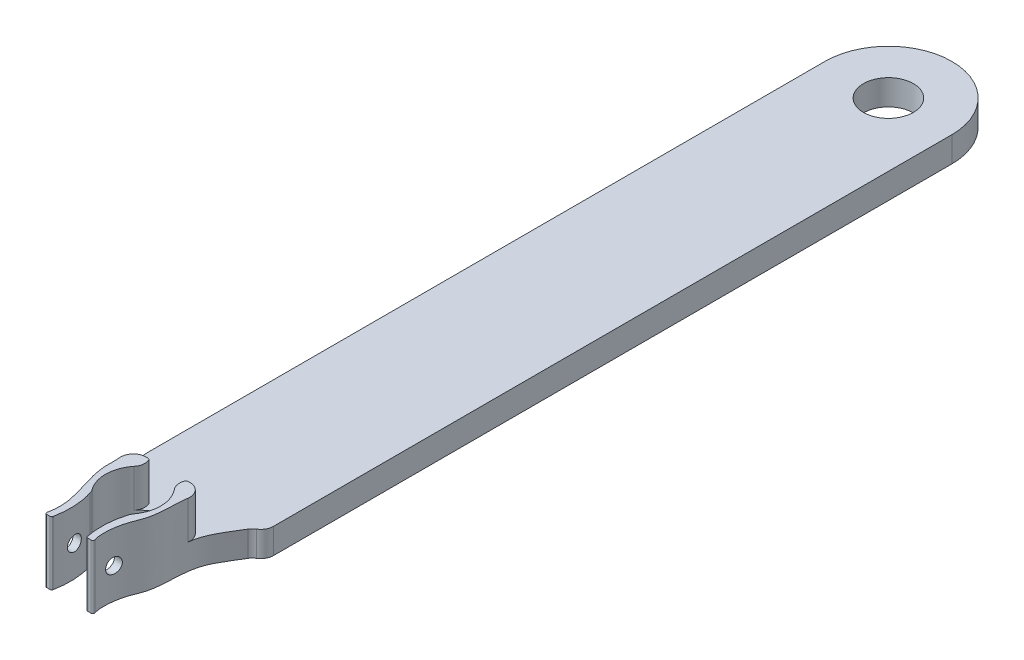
SolidWorks part; units mm, degrees
ref_plane "Front Plane" through (0, 0, 0) normal (0, 0, 1) x (1, 0, 0)
ref_plane "Top Plane" through (0, 0, 0) normal (0, 1, 0) x (1, 0, 0)
ref_plane "Right Plane" through (0, 0, 0) normal (1, 0, 0) x (0, 0, -1)
sketch "Sketch1" plane through (0, 0, 0) normal (0, 1, 0) x (1, 0, 0)
  line L0 (0, 12.7) -> (0, -18.5764) construction
  line L1 (-4.4511, -32.1986) -> (-3.776, -32.1986)
  line L2 (4.4511, -32.1986) -> (3.776, -32.1986)
  arc A0 (-12.6901, -0.502) -> (12.6901, -0.502) centre (0, 0) cw
  circle A1 centre (0, 0) radius 2.54
  arc A2 (-12.6901, -0.502) -> (12.6901, -0.502) centre (0, 0) ccw construction
  arc A3 (0, -12.7) -> (-4.2124, -23.3606) centre (1.256, -19.3588) ccw
  arc A4 (-4.2124, -23.3606) -> (-3.8349, -24.1124) centre (-6.2622, -24.8607) cw
  arc A5 (-3.4519, -31.9324) -> (-3.776, -32.1986) centre (-3.776, -31.8683) cw
  arc A6 (-4.7735, -31.7962) -> (-4.4511, -32.1986) centre (-4.4511, -31.8683) ccw
  arc A7 (4.7735, -31.7962) -> (4.4511, -32.1986) centre (4.4511, -31.8683) cw
  arc A8 (3.4519, -31.9324) -> (3.776, -32.1986) centre (3.776, -31.8683) ccw
  arc A9 (4.2124, -23.3606) -> (3.8349, -24.1124) centre (6.2622, -24.8607) ccw
  arc A10 (0, -12.7) -> (4.2124, -23.3606) centre (-1.256, -19.3588) cw
  spline S0 degree 3 poles (-12.6901, -0.502) (-12.7086, -0.5346) (-12.9445, -3.8187) (-6.4425, -13.8865) (-7.3603, -18.4592) (-5.2739, -24.7591) (-4.156, -29.0329) (-4.7735, -31.7962) knots 0 0 0 0 0.279659 0.433864 0.566787 0.759909 0.988954 0.988954 0.988954 0.988954
  spline S1 degree 3 poles (-3.8349, -24.1124) (-3.6668, -24.6575) (-3.0286, -27.202) (-3.0384, -29.8419) (-3.4519, -31.9324) knots 0.055076 0.055076 0.055076 0.055076 0.252507 0.96957 0.96957 0.96957 0.96957
  spline S2 degree 3 poles (3.8349, -24.1124) (3.6668, -24.6575) (3.0286, -27.202) (3.0384, -29.8419) (3.4519, -31.9324) knots 0.055076 0.055076 0.055076 0.055076 0.252507 0.96957 0.96957 0.96957 0.96957
  spline S3 degree 3 poles (12.6901, -0.502) (12.8342, -5.638) (5.4885, -11.2875) (7.0856, -20.9954) (4.5252, -26.6602) (4.2626, -30.148) (4.7735, -31.7962) knots 0 0 0 0 0.420411 0.703009 0.760968 1 1 1 1
  dimension "D1" = 12.7
  dimension "D2" = 5.08
  dimension "D3" = 2.54
  dimension "D4" = 0.3304
extrude "Boss-Extrude1" add sketch "Sketch1" along normal blind 12.7
ref_plane "Plane1" through (0, 5.08, 0) normal (0, 1, 0) x (1, 0, 0)
ref_plane "Plane4" through (7.62, 0, 0) normal (1, 0, 0) x (0, 0, -1)
sketch "Sketch2" plane through (0, 5.08, 0) normal (0, 1, 0) x (1, 0, 0)
  line L0 (-12.7, 0) -> (-12.7, -8.89)
  line L1 (-12.7, -8.89) -> (12.7, -8.89)
  line L2 (12.7, -8.89) -> (12.7, 0)
  arc A0 (-12.7, 0) -> (12.7, 0) centre (0, 0) cw
  arc A1 (12.6901, -0.502) -> (-12.6901, -0.502) centre (0, 0) ccw construction
  dimension "D1" = 8.89
extrude "Cut-Extrude1" cut sketch "Sketch2" along normal up to next
fillet "Fillet1" radius 2.54 2 edges
sketch "Sketch3" plane through (0, 5.08, 0) normal (0, 1, 0) x (1, 0, 0)
  line L0 (-12.7, -6.35) -> (12.7, -6.35)
  line L1 (-12.7, -6.35) -> (-12.7, 131.826)
  line L2 (12.7, -6.35) -> (12.7, 131.826)
  arc A0 (-12.7, 131.826) -> (12.7, 131.826) centre (0, 131.826) cw
  dimension "D1" = 6.35
  dimension "D2" = 12.7
  dimension "D3" = 25.4
  dimension "D4" = 138.176
extrude "Boss-Extrude2" add sketch "Sketch3" against normal blind 5.08
fillet "Fillet2" radius 2.54 2 edges at (12.7, 2.54, 6.35) (-12.7, 2.54, 6.35)
fillet "Fillet3" radius 2.54 1 edges at (-10.9754, 2.54, 6.35)
fillet "Fillet4" radius 2.54 1 edges at (10.9914, 2.54, 6.35)
sketch "Sketch4" plane through (0, 5.08, 0) normal (0, 1, 0) x (1, 0, 0)
  circle A0 centre (0, 131.826) radius 5
  arc A1 (12.7, 131.826) -> (-12.7, 131.826) centre (0, 131.826) ccw construction
  dimension "D1" = 10
extrude "Cut-Extrude2" cut sketch "Sketch4" against normal blind 5.08
sketch "Sketch5" plane through (0, 5.08, 0) normal (0, 1, 0) x (1, 0, 0)
  line L0 (-12.7, 0) -> (-12.7, -7.3879)
  line L1 (-12.7, 131.826) -> (-12.7, -3.9444) construction
  line L2 (-12.7, -7.3879) -> (-10.6408, -7.3879)
  line L3 (10.6408, -7.3879) -> (12.7, -7.3879)
  line L4 (12.7, -7.3879) -> (12.7, 0)
  line L5 (12.7, -3.9499) -> (12.7, 131.826) construction
  line L6 (-12.7, 0) -> (12.7, 0)
  arc A0 (10.6408, -7.3879) -> (-10.6408, -7.3879) centre (0, 0) cw
  dimension "D1" = 12.954
extrude "Cut-Extrude4" cut sketch "Sketch5" along normal up to next
fillet "Fillet5" radius 2.54 2 edges at (7.6086, 8.89, 10.4841) (-7.7356, 8.89, 10.3907)
hole_wizard "#4 Clearance Hole1" positions "Sketch7" profile "Sketch6" hole size "#4" standard "ANSI Inch"
sketch "Sketch7" plane through (7.62, 0, 0) normal (1, 0, 0) x (0, 0, -1)
  point P0 (-27.8809, 6.1917)
sketch "Sketch6" plane through (7.62, 6.1917, 27.8809) normal (0, 1, 0) x (0, 0, -1)
  line L0 (0, 0) -> (0, 20.32)
  line L1 (0, 20.32) -> (1.4732, 20.32)
  line L2 (1.4732, 20.32) -> (1.4732, 0)
  line L5 (1.4732, 0) -> (0, 0)
  line L11 (0, -6.35) -> (0, 107.95) construction
  dimension "Thru Hole Dia." = 2.9464
  dimension "Thru Hole Depth" = 20.32
fillet "Fillet6" radius 2.54 2 edges at (0.8701, 8.89, 12.9247) (-0.8701, 8.89, 12.9247)
